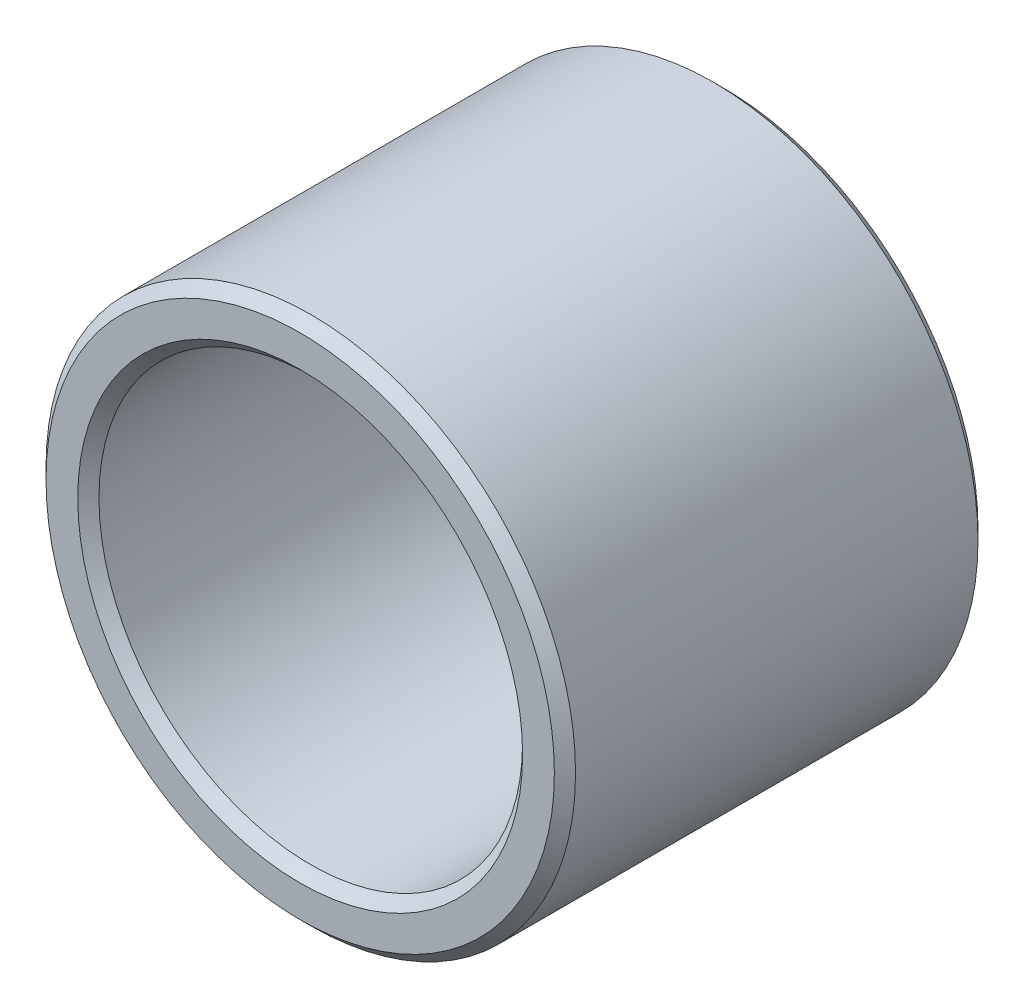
SolidWorks part; units mm, degrees
ref_plane "Plan de face" through (0, 0, 0) normal (0, 0, 1) x (1, 0, 0)
ref_plane "Plan de dessus" through (0, 0, 0) normal (0, 1, 0) x (1, 0, 0)
ref_plane "Plan de droite" through (0, 0, 0) normal (1, 0, 0) x (0, 0, -1)
sketch "Esquisse1" plane through (0, 0, 0) normal (0, 0, 1) x (1, 0, 0)
  circle A0 centre (0, 0) radius 20
  circle A1 centre (0, 0) radius 25
extrude "Extrusion1" add sketch "Esquisse1" along normal blind 40
chamfer "Chanfrein1" distance 1 angle 45 4 edges at (25, 0, 0) (25, 0, 40) (20, 0, 0) (20, 0, 40)
